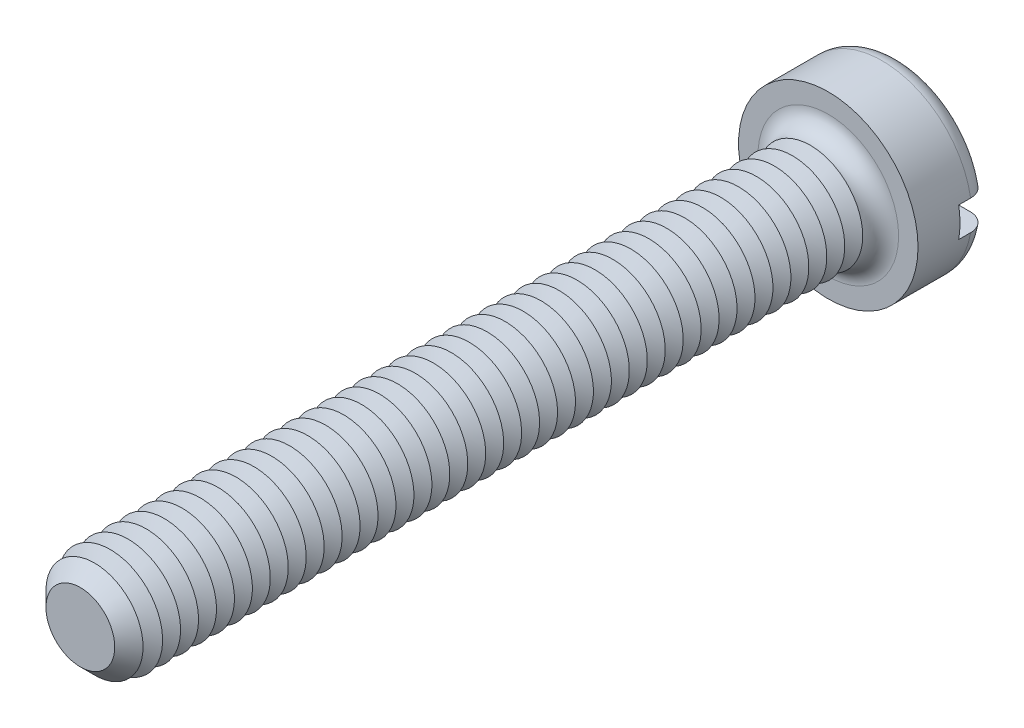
SolidWorks part; units mm, degrees
ref_plane "Front Plane" through (0, 0, 0) normal (0, 0, 1) x (1, 0, 0)
ref_plane "Top Plane" through (0, 0, 0) normal (0, 1, 0) x (1, 0, 0)
ref_plane "Right Plane" through (0, 0, 0) normal (1, 0, 0) x (0, 0, -1)
sketch "Sketch3" plane through (0, 0, 0) normal (0, 0, 1) x (1, 0, 0)
  circle A0 centre (0, 0) radius 3
  dimension "D1" = 6
extrude "Boss-Extrude2" add sketch "Sketch3" against normal blind 2.4
sketch "Sketch4" plane through (0, 0, 0) normal (0, 0, 1) x (1, 0, 0)
  circle A0 centre (0, 0) radius 1.75
  dimension "D1" = 3.5
extrude "Boss-Extrude3" add sketch "Sketch4" along normal blind 25
fillet "Fillet1" radius 0.6 2 edges at (3, 0, -2.4) (1.75, 0, 0)
chamfer "Chamfer1" distance 0.6 angle 45 1 edges at (1.75, 0, 25)
sketch "Sketch5" plane through (0, 0, 0) normal (1, 0, 0) x (0, 0, -1)
  line L0 (1.6944, 0) -> (-7.6738, 0) construction
sketch "Sketch6" plane through (0, 0, 0) normal (1, 0, 0) x (0, 0, -1)
  line L0 (-0.6, 1.75) -> (-0.9, 1.2304)
  line L1 (-0.9, 1.2304) -> (-1.2, 1.75)
  line L2 (-0.6, 1.75) -> (-24.4, 1.75) construction
  line L3 (-1.2, 1.75) -> (-0.6, 1.75)
  dimension "D1" = 0.6
revolve "Cut-Revolve1" cut sketch "Sketch6" angle 360 about L0
pattern_linear "LPattern1" count 40 spacing 0.6 along (0, 0, 1) of "Cut-Revolve1"
sketch "Sketch8" plane through (0, 0, -2.4) normal (0, 0, -1) x (-1, 0, 0)
  line L1 (3, -0.5) -> (-3, -0.5)
  line L2 (3, -0.5) -> (3, 0.5)
  line L3 (3, 0.5) -> (-3, 0.5)
  line L4 (-3, -0.5) -> (-3, 0.5)
  line L5 (3, -0.5) -> (-3, 0.5) construction
  line L6 (3, 0.5) -> (-3, -0.5) construction
  point P0 (0, 0)
  dimension "D1" = 6
  dimension "D2" = 1
extrude "Cut-Extrude1" cut sketch "Sketch8" against normal blind 1
